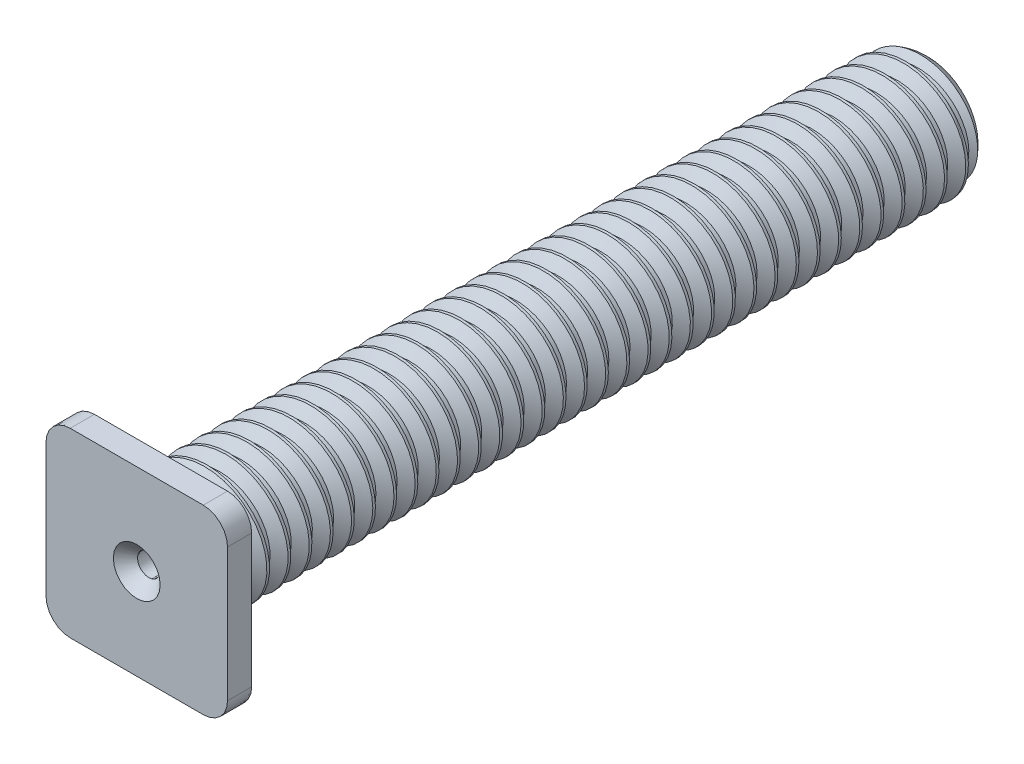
SolidWorks part; units mm, degrees
ref_plane "Спереди" through (0, 0, 0) normal (0, 0, 1) x (1, 0, 0)
ref_plane "Сверху" through (0, 0, 0) normal (0, 1, 0) x (1, 0, 0)
ref_plane "Справа" through (0, 0, 0) normal (1, 0, 0) x (0, 0, -1)
sketch "Эскиз1" plane through (0, 0, 0) normal (0, 0, 1) x (1, 0, 0)
  circle A0 centre (0, 0) radius 10
  dimension "D1" = 20
extrude "Бобышка-Вытянуть1" add sketch "Эскиз1" along normal blind 128
sketch "Эскиз2" plane through (0, 0, 128) normal (0, 0, 1) x (1, 0, 0)
  line L1 (-15, -15) -> (15, -15)
  line L2 (-15, -15) -> (-15, 15)
  line L3 (-15, 15) -> (15, 15)
  line L4 (15, -15) -> (15, 15)
  line L5 (-15, -15) -> (15, 15) construction
  line L6 (-15, 15) -> (15, -15) construction
  point P0 (0, 0)
  dimension "D1" = 30
extrude "Бобышка-Вытянуть2" add sketch "Эскиз2" along normal blind 4
fillet "Скругление1" radius 4 4 edges at (-15, -15, 130) (-15, 15, 130) (15, -15, 130) (15, 15, 130)
fillet "Скругление2" radius 5 1 edges at (10, 0, 0)
thread "Резьба1" pitch 3.5 start angle 0, offset 7, length 124, pitch 3.5, diameter 20
ref_plane "Плоскость2" through (10, 0, -2) normal (0, -1, 0) x (1, 0, 0)
sketch "Профиль резьбы2" plane through (10, 0, -2) normal (0, -1, 0) x (1, 0, 0)
  line L0 (0, 0) -> (0, 3.5) construction
  line L11 (0, 0) -> (0, 3.0625)
  line L12 (0, 3.0625) -> (-1.8944, 1.9687)
  line L13 (-1.8944, 1.9687) -> (-1.8944, 1.0937)
  line L15 (-1.8944, 1.0937) -> (0, 0)
  line L17 (-1.8944, 1.5312) -> (0, 1.5312) construction
  point P2 (0, 0)
  dimension "Pitch" = 3.5
  dimension "Profile_Angle" = 60
  dimension "Profile_Land" = 0.875
  dimension "Profile_Height" = 1.8944
sketch "Эскиз3" plane through (0, 0, 132) normal (0, 0, 1) x (1, 0, 0)
  circle A0 centre (0, 0) radius 1.875
  dimension "D1" = 3.75
extrude "Вырез-Вытянуть1" cut sketch "Эскиз3" against normal blind 50
chamfer "Фаска1" distance 2 angle 45 1 edges at (1.875, 0, 132)
